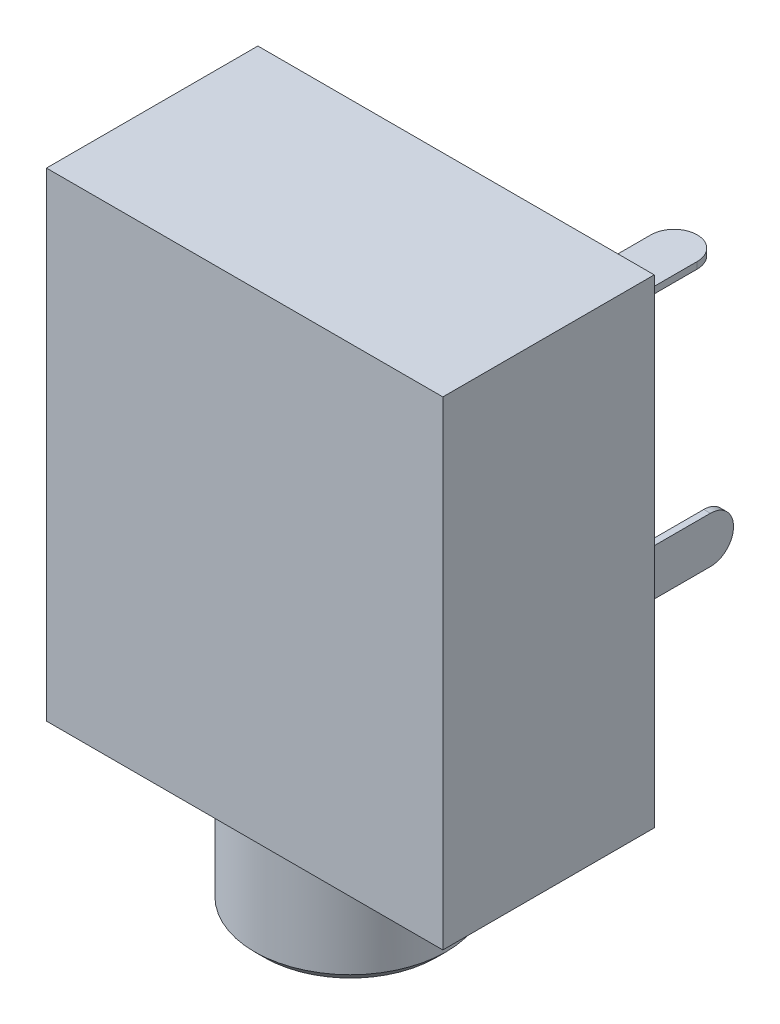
SolidWorks part; units mm, degrees
ref_plane "Face" through (0, 0, 0) normal (0, 0, 1) x (1, 0, 0)
ref_plane "Dessus" through (0, 0, 0) normal (0, 1, 0) x (1, 0, 0)
ref_plane "Droite" through (0, 0, 0) normal (1, 0, 0) x (0, 0, -1)
sketch "Esquisse1" plane through (0, 0, 0) normal (0, 0, 1) x (1, 0, 0)
  line L0 (-14.4777, 0) -> (43.1519, 0) construction
  line L1 (0, 41.0435) -> (0, -39.0757) construction
  line L2 (-11.9476, 14.5) -> (36.6861, 14.5) construction
  line L3 (12, 21.9273) -> (12, -9.8392) construction
  line L5 (0, 14.5) -> (12, 14.5)
  line L6 (0, 14.5) -> (0, 0)
  line L7 (0, 0) -> (12, 0)
  line L8 (12, 14.5) -> (12, 0)
extrude "Base-Extrusion" add sketch "Esquisse1" along normal blind 6.4
sketch "Esquisse2" plane through (0, 0, 0) normal (0, 0, -1) x (-1, 0, 0)
  line L0 (-8.0873, 0.8) -> (-5.0245, 0.8) construction
  line L1 (-6, 1.8377) -> (-6, -0.1343) construction
  line L2 (-12.3039, 5.6) -> (-7.3111, 5.6) construction
  line L3 (-10.8, 6.8514) -> (-10.8, 4.4809) construction
  line L4 (-12.3039, 12.6) -> (-9.4299, 12.6) construction
  line L5 (-9.8, 13.4) -> (-9.8, 11.4456) construction
  line L6 (-4.6679, 8.1) -> (-2.2764, 8.1) construction
  line L7 (-3.7, 8.9282) -> (-3.7, 5.8025) construction
  line L8 (-2.0876, 9.3) -> (0.5766, 9.3) construction
  line L9 (-1.3, 10.124) -> (-1.3, 8.4667) construction
  line L11 (-9.1, 12.5) -> (-10.5, 12.5)
  line L12 (-9.1, 12.5) -> (-9.1, 12.7)
  line L13 (-9.1, 12.7) -> (-10.5, 12.7)
  line L14 (-10.5, 12.5) -> (-10.5, 12.7)
  line L15 (-10.7, 6.3) -> (-10.9, 6.3)
  line L16 (-10.7, 6.3) -> (-10.7, 4.9)
  line L17 (-10.7, 4.9) -> (-10.9, 4.9)
  line L18 (-10.9, 6.3) -> (-10.9, 4.9)
  line L19 (-3.6, 8.8) -> (-3.8, 8.8)
  line L20 (-3.6, 8.8) -> (-3.6, 7.4)
  line L21 (-3.6, 7.4) -> (-3.8, 7.4)
  line L22 (-3.8, 8.8) -> (-3.8, 7.4)
  line L23 (-1.2, 10) -> (-1.4, 10)
  line L24 (-1.2, 10) -> (-1.2, 8.6)
  line L25 (-1.2, 8.6) -> (-1.4, 8.6)
  line L26 (-1.4, 10) -> (-1.4, 8.6)
  line L27 (-5.3, 0.7) -> (-6.7, 0.7)
  line L28 (-5.3, 0.7) -> (-5.3, 0.9)
  line L29 (-5.3, 0.9) -> (-6.7, 0.9)
  line L30 (-6.7, 0.7) -> (-6.7, 0.9)
extrude "Boss.-Extru.1" add sketch "Esquisse2" along normal blind 3.5
fillet "Congé1" radius 0.7
sketch "Esquisse3" plane through (0, 0, 0) normal (0, -1, 0) x (1, 0, 0)
  line L0 (6, 4.7951) -> (6, -2.8568) construction
  line L1 (7.1285, 3.2) -> (4.2465, 3.2) construction
  circle A0 centre (6, 3.2) radius 2.9
  circle A1 centre (6, 3.2) radius 1.7
extrude "Boss.-Extru.2" add sketch "Esquisse3" along normal blind 3.5
sketch "Esquisse4" plane through (0, 0, 0) normal (0, -1, 0) x (1, 0, 0)
  line L0 (6, 6) -> (6, -4.0674) construction
  line L1 (5.2493, 3.2) -> (10, 3.2) construction
  circle A0 centre (6, 3.2) radius 1.7
extrude "Enlèv. mat.-Extru.1" cut sketch "Esquisse4" against normal blind 13.5
chamfer "Chanfrein1" distance 0.3 angle 45
chamfer "Chanfrein2" distance 0.5 angle 45
